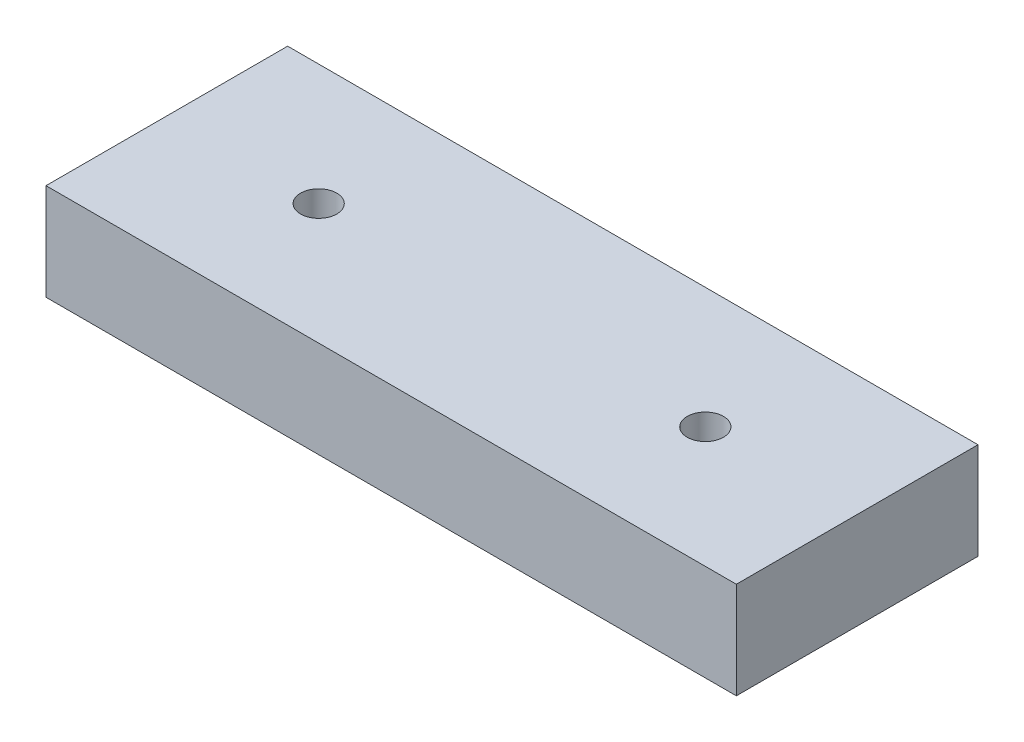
SolidWorks part; units mm, degrees
ref_plane "Front" through (0, 0, 0) normal (0, 0, 1) x (1, 0, 0)
ref_plane "Top" through (0, 0, 0) normal (0, 1, 0) x (1, 0, 0)
ref_plane "Right" through (0, 0, 0) normal (1, 0, 0) x (0, 0, -1)
sketch "Sketch1" plane through (0, 0, 0) normal (0, 1, 0) x (1, 0, 0)
  line L1 (90.7034, 31.75) -> (-90.7034, 31.75)
  line L2 (90.7034, 31.75) -> (90.7034, -31.75)
  line L3 (90.7034, -31.75) -> (-90.7034, -31.75)
  line L4 (-90.7034, 31.75) -> (-90.7034, -31.75)
  circle A0 centre (50.8, 0) radius 4.7625
  circle A1 centre (-50.8, 0) radius 4.7625
  point P0 (90.7034, 31.75)
extrude "Extrude1" add sketch "Sketch1" along normal blind 25.4
